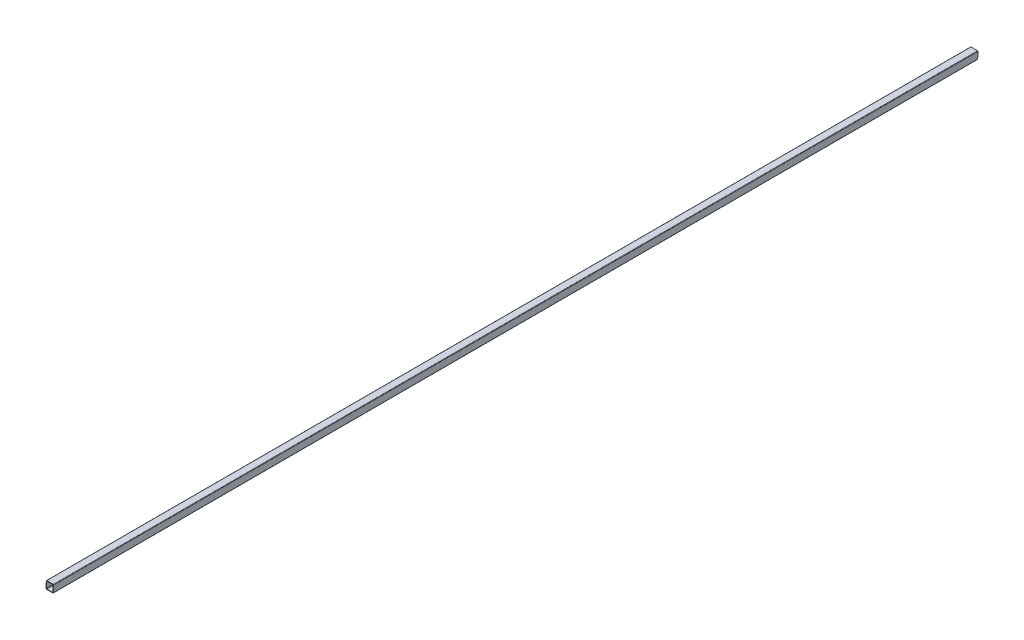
SolidWorks part; units mm, degrees
ref_plane "Plan de face" through (0, 0, 0) normal (0, 0, 1) x (1, 0, 0)
ref_plane "Plan de dessus" through (0, 0, 0) normal (0, 1, 0) x (1, 0, 0)
ref_plane "Plan de droite" through (0, 0, 0) normal (1, 0, 0) x (0, 0, -1)
sketch "Esquisse1" plane through (0, 0, 0) normal (0, 0, 1) x (1, 0, 0)
  line L1 (-35, 35) -> (35, 35)
  line L2 (-35, 35) -> (-35, -35)
  line L3 (-35, -35) -> (35, -35)
  line L4 (35, 35) -> (35, -35)
  line L5 (-40, 40) -> (40, 40)
  line L6 (-40, 40) -> (-40, -40)
  line L7 (-40, -40) -> (40, -40)
  line L8 (40, 40) -> (40, -40)
  dimension "D1" = 80
  dimension "D2" = 80
  dimension "D3" = 40
  dimension "D4" = 40
  dimension "D5" = 5
  dimension "D6" = 5
  dimension "D7" = 5
  dimension "D8" = 5
extrude "Boss.-Extru.1" add sketch "Esquisse1" along normal blind 10200
sketch "Esquisse2" plane through (40, 0, 0) normal (1, 0, 0) x (0, 0, -1)
  line L0 (0, 40) -> (-5.3959, -67.919)
  line L1 (0, -40) -> (0, 40) construction
  line L2 (0, 40) -> (74.9616, 49.1635)
  line L3 (74.9616, 49.1635) -> (70.3028, -76.6252)
  line L4 (70.3028, -76.6252) -> (-5.3959, -67.919)
  dimension "D1" = 2.862
extrude "Enlèv. mat.-Extru.1" cut sketch "Esquisse2" against normal through all
fillet "Congé1" radius 5 8 edges at (-35, -35, 5101.875) (35, 35, 5100.125) (-35, 35, 5100.125) (35, -35, 5101.875) (40, -40, 5102) (-40, -40, 5102) (-40, 40, 5100) (40, 40, 5100)
sketch "Esquisse3" plane through (40, 0, 0) normal (1, 0, 0) x (0, 0, -1)
  line L0 (-10012.49, 2255.2156) -> (-10012.49, -870.9261) construction
  line L1 (-10012.49, 40) -> (-10017.8166, -66.5322)
  line L2 (-10200, 40) -> (0, 40) construction
  line L3 (-10017.8166, -66.5322) -> (-10226.996, -66.5322)
  line L4 (-10226.996, -66.5322) -> (-10226.996, 77.7331)
  line L5 (-10226.996, 77.7331) -> (-10012.49, 77.7331)
  line L6 (-10012.49, 77.7331) -> (-10012.49, 40)
  dimension "D1" = 10012.49
  dimension "D2" = 2.862
extrude "Enlèv. mat.-Extru.2" cut sketch "Esquisse3" against normal through all
